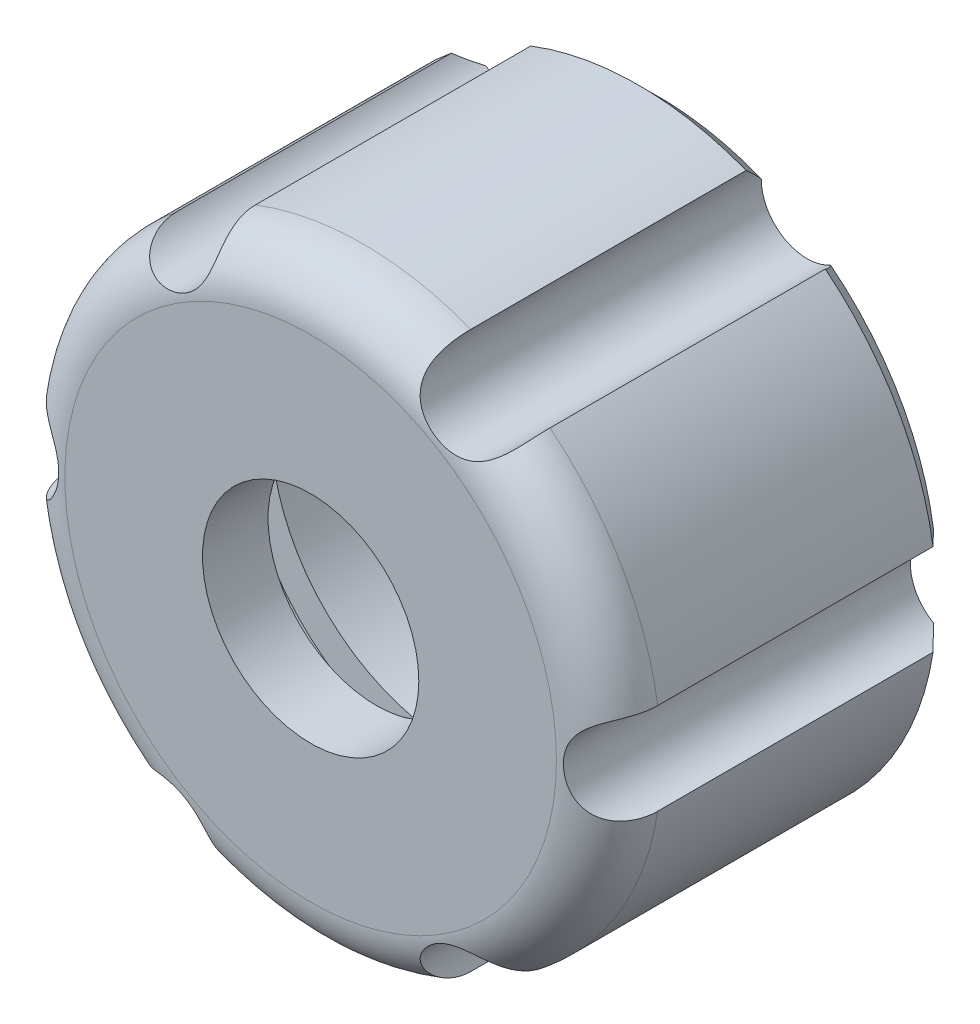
SolidWorks part; units mm, degrees
ref_plane "正面" through (0, 0, 0) normal (0, 0, 1) x (1, 0, 0)
ref_plane "平面" through (0, 0, 0) normal (0, 1, 0) x (1, 0, 0)
ref_plane "右側面" through (0, 0, 0) normal (1, 0, 0) x (0, 0, -1)
sketch "ｽｹｯﾁ1" plane through (0, 0, 0) normal (0, 0, 1) x (1, 0, 0)
  circle A0 centre (0, 0) radius 22.75
  dimension "D1" = 45.5
extrude "ﾎﾞｽ - 押し出し1" add sketch "ｽｹｯﾁ1" against normal blind 26.5
ref_plane "m-奥行" through (0, 0, -5) normal (0, 0, 1) x (1, 0, 0)
sketch "ｽｹｯﾁ2" plane through (0, 0, -26.5) normal (0, 0, -1) x (-1, 0, 0)
  circle A0 centre (0, 0) radius 14
  dimension "D1" = 28
extrude "ｶｯﾄ - 押し出し1" cut sketch "ｽｹｯﾁ2" against normal up to surface (21.5 mm away)
sketch "ｽｹｯﾁ3" plane through (0, 0, -5) normal (0, 0, 1) x (1, 0, 0)
  circle A0 centre (0, 0) radius 16.5
  dimension "D1" = 33
extrude "ｶｯﾄ - 押し出し2" cut sketch "ｽｹｯﾁ3" against normal blind 6
sketch "ｽｹｯﾁ4" plane through (0, 0, 0) normal (0, 0, 1) x (1, 0, 0)
  circle A0 centre (0, 0) radius 8.25
  dimension "D1" = 16.5
extrude "ｶｯﾄ - 押し出し3" cut sketch "ｽｹｯﾁ4" against normal through all
fillet "ﾌｨﾚｯﾄ1" radius 4 1 edges at (22.75, 0, 0)
chamfer "面取り1" distance 1.5 angle 45 1 edges at (22.75, 0, -26.5)
sketch "ｽｹｯﾁ5" plane through (0, 0, 0) normal (0, 0, 1) x (1, 0, 0)
  line L0 (0, 0) -> (22.75, 0) construction
  circle A0 centre (0, 0) radius 22.75 construction
  circle A1 centre (22.75, 0) radius 3.5
  dimension "D1" = 7
extrude "ｶｯﾄ - 押し出し4" cut sketch "ｽｹｯﾁ5" against normal through all
pattern_circular "円形ﾊﾟﾀｰﾝ1" count 6 over 360 about axis through (0, 0, 0) along (0, 0, 1) of "ｶｯﾄ - 押し出し4"
